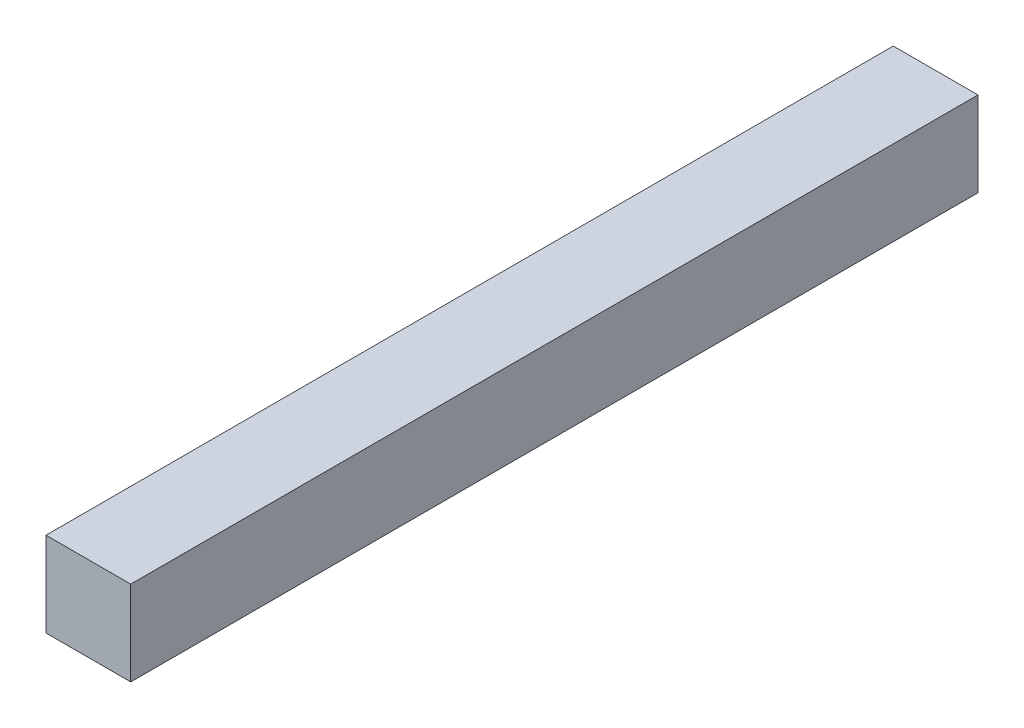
SolidWorks part; units mm, degrees
ref_plane "Front" through (0, 0, 0) normal (0, 0, 1) x (1, 0, 0)
ref_plane "Top" through (0, 0, 0) normal (0, 1, 0) x (1, 0, 0)
ref_plane "Right" through (0, 0, 0) normal (1, 0, 0) x (0, 0, -1)
sketch "Sketch1" plane through (0, 0, 0) normal (0, 0, 1) x (1, 0, 0)
  line L1 (0, 0) -> (25.4, 0)
  line L2 (0, 0) -> (0, 25.4)
  line L3 (0, 25.4) -> (25.4, 25.4)
  line L4 (25.4, 0) -> (25.4, 25.4)
  dimension "D1" = 25.4
  dimension "D2" = 25.4
extrude "Extrude1" add sketch "Sketch1" against normal blind 254
